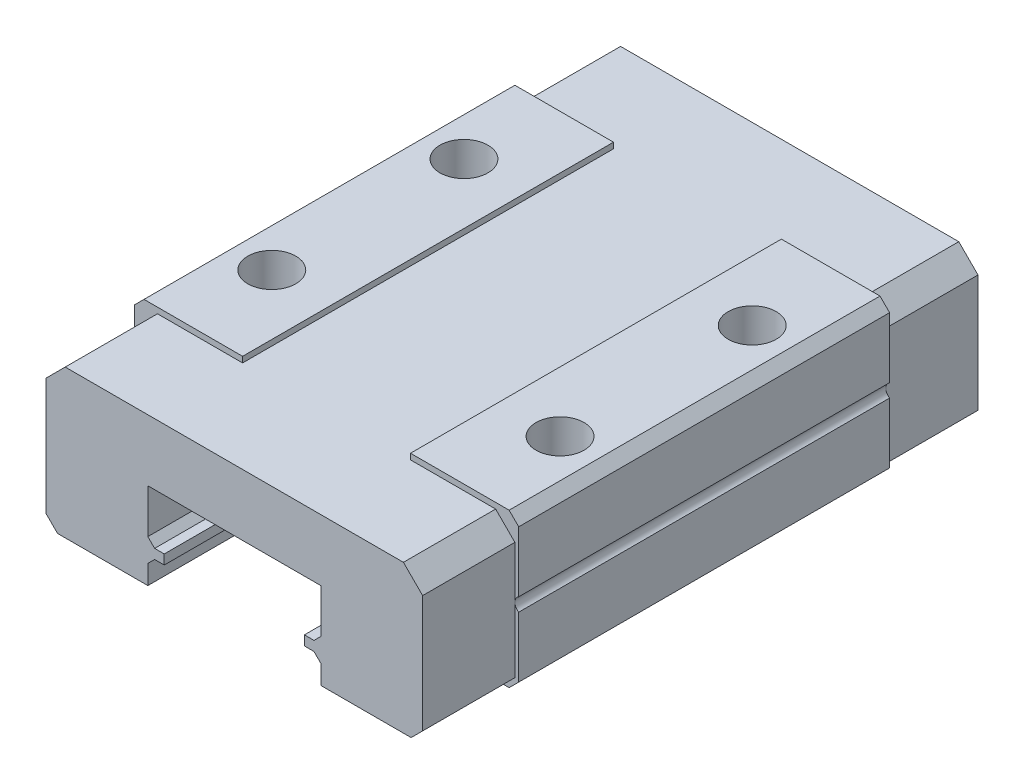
SolidWorks part; units mm, degrees
ref_plane "前视基准面" through (0, 0, 0) normal (0, 0, 1) x (1, 0, 0)
ref_plane "上视基准面" through (0, 0, 0) normal (0, 1, 0) x (1, 0, 0)
ref_plane "右视基准面" through (0, 0, 0) normal (1, 0, 0) x (0, 0, -1)
sketch "草图1" plane through (0, 0, 0) normal (0, 0, 1) x (1, 0, 0)
  line L0 (0, 0) -> (0, 18.7331) construction
  line L1 (-10, 0) -> (-10, 8)
  line L2 (4.5, 0) -> (4.5, 1)
  line L3 (4.5, 1) -> (4.1464, 1.3536)
  line L4 (4.1464, 1.3536) -> (3.6464, 1.3536)
  line L5 (3.6464, 1.3536) -> (3.6464, 1.8536)
  line L6 (3.6464, 1.8536) -> (4.1464, 1.8536)
  line L7 (4.1464, 1.8536) -> (4.5, 2.2071)
  line L8 (4.5, 2.2071) -> (4.5, 4.5)
  line L9 (4.5, 4.5) -> (-4.5, 4.5)
  line L10 (4.5, 0) -> (10, 0)
  line L11 (10, 0) -> (10, 8)
  line L12 (10, 8) -> (-10, 8)
  line L13 (-4.5, 0) -> (-10, 0)
  line L14 (-4.5, 2.2071) -> (-4.5, 4.5)
  line L15 (-4.1464, 1.8536) -> (-4.5, 2.2071)
  line L16 (-3.6464, 1.8536) -> (-4.1464, 1.8536)
  line L17 (-3.6464, 1.3536) -> (-3.6464, 1.8536)
  line L18 (-4.1464, 1.3536) -> (-3.6464, 1.3536)
  line L19 (-4.5, 1) -> (-4.1464, 1.3536)
  line L20 (-4.5, 0) -> (-4.5, 1)
  point P16 (0, 8)
  point P19 (0, 4.5)
  dimension "D1" = 4.5
  dimension "D2" = 1
  dimension "D3" = 0.5
  dimension "D4" = 0.5
  dimension "D5" = 0.5
  dimension "D6" = 4.5
  dimension "D7" = 10
  dimension "D8" = 8
extrude "凸台-拉伸1" add sketch "草图1" against normal blind 28.9
sketch "草图2" plane through (0, 8, 0) normal (0, 1, 0) x (1, 0, 0)
  line L0 (0, 28.9) -> (0, 0) construction
  line L1 (10, 28.9) -> (-10, 28.9) construction
  line L2 (10, 14.45) -> (-10, 14.45) construction
  line L3 (10, 28.9) -> (10, 0) construction
  line L4 (-10, 28.9) -> (-10, 0) construction
hole_wizard "M3 螺纹孔1" positions "草图4" profile "草图3" tap size "M3" standard "Gb"
sketch "草图4" plane through (0, 8, 0) normal (0, 1, 0) x (1, 0, 0)
  line L0 (0, 28.9) -> (0, 0) construction
  line L1 (10, 14.45) -> (-10, 14.45) construction
  point P0 (7.5, 19.45)
  dimension "D1" = 7.5
  dimension "D2" = 5
sketch "草图3" plane through (7.5, 8, -19.45) normal (1, 0, 0) x (0, 0, 1)
  line L0 (0, 0) -> (0, 3.7511)
  line L1 (0, 3.7511) -> (1.25, 3)
  line L2 (1.25, 3) -> (1.25, 0)
  line L5 (1.25, 0) -> (0, 0)
  line L10 (0, 3.7511) -> (-1.25, 3) construction
  line L11 (0, -6.35) -> (0, 107.95) construction
  dimension "螺纹孔钻头直径" = 2.5
  dimension "螺纹孔钻头深度" = 3
  dimension "导头角度" = 118
ref_plane "基准面1" through (0, 0, -14.45) normal (0, 0, -1) x (-1, 0, 0)
ref_plane "基准面2" through (0, 0, 0) normal (-1, 0, 0) x (0, 0, 1)
mirror "镜向1" about plane through (0, 0, -14.45) normal (0, 0, -1) of "M3 螺纹孔1"
mirror "镜向2" about plane through (0, 0, 0) normal (-1, 0, 0) of "镜向1", "M3 螺纹孔1"
chamfer "倒角1" distance 0.5 angle 45 2 edges at (10, 8, -14.45) (-10, 8, -14.45)
sketch "草图5" plane through (0, 8, 0) normal (0, 1, 0) x (1, 0, 0)
  line L0 (-9.5, 24.1) -> (-4.3686, 24.1)
  line L1 (-9.5, 28.9) -> (-9.5, 0) construction
  line L2 (-4.3686, 24.1) -> (-4.3686, 4.8)
  line L3 (-4.3686, 4.8) -> (-9.5, 4.8)
  line L4 (0, 28.9) -> (0, -1.0585) construction
  line L5 (9.5, 28.9) -> (-9.5, 28.9) construction
  line L6 (4.3686, 4.8) -> (9.5, 4.8)
  line L7 (4.3686, 24.1) -> (4.3686, 4.8)
  line L8 (9.5, 24.1) -> (4.3686, 24.1)
  line L9 (9.5, 0) -> (-9.5, 0) construction
  line L10 (-9.5, 24.1) -> (-10, 24.1)
  line L11 (-10, 0) -> (-10, 28.9) construction
  line L12 (-10, 24.1) -> (-10, 28.9)
  line L13 (-10, 28.9) -> (10, 28.9)
  line L14 (10, 28.9) -> (10, 24.1)
  line L15 (10, 28.9) -> (10, 0) construction
  line L16 (10, 24.1) -> (9.5, 24.1)
  line L17 (9.5, 4.8) -> (10, 4.8)
  line L18 (10, 4.8) -> (10, 0)
  line L19 (10, 0) -> (-10, 0)
  line L20 (-10, 0) -> (-10, 4.8)
  line L21 (-10, 4.8) -> (-9.5, 4.8)
  dimension "D1" = 4.8
  dimension "D2" = 4.8
extrude "切除-拉伸1" cut sketch "草图5" against normal blind 0.3
sketch "草图6" plane through (0, 7.7, 0) normal (0, 1, 0) x (1, 0, 0)
  line L0 (-10, 28.9) -> (-9.8, 28.9)
  line L1 (9.8, 28.9) -> (-9.8, 28.9) construction
  line L2 (-9.8, 28.9) -> (-9.8, 24.1)
  line L3 (-9.8, 24.1) -> (-10, 24.1)
  line L4 (-10, 0) -> (-10, 28.9) construction
  line L5 (-10, 24.1) -> (-10, 28.9)
  line L6 (0, 28.9) -> (0, 0) construction
  line L7 (-10, 14.45) -> (10, 14.45) construction
  line L8 (10, 28.9) -> (10, 0) construction
  line L9 (10, 24.1) -> (10, 28.9)
  line L10 (9.8, 24.1) -> (10, 24.1)
  line L11 (9.8, 28.9) -> (9.8, 24.1)
  line L12 (10, 28.9) -> (9.8, 28.9)
  line L13 (10, 0) -> (9.8, 0)
  line L14 (9.8, 0) -> (9.8, 4.8)
  line L15 (9.8, 4.8) -> (10, 4.8)
  line L16 (10, 4.8) -> (10, 0)
  line L17 (-10, 4.8) -> (-10, 0)
  line L18 (-9.8, 4.8) -> (-10, 4.8)
  line L19 (-9.8, 0) -> (-9.8, 4.8)
  line L20 (-10, 0) -> (-9.8, 0)
extrude "切除-拉伸2" cut sketch "草图6" against normal blind 8.3
chamfer "倒角2" distance 1 angle 45 4 edges at (-9.8, 7.7, -26.5) (9.8, 7.7, -26.5) (9.8, 7.7, -2.4) (-9.8, 7.7, -2.4)
chamfer "倒角3" distance 0.6 angle 45 4 edges at (9.8, 0, -2.4) (-9.8, 0, -2.4) (-9.8, 0, -26.5) (9.8, 0, -26.5)
chamfer "倒角4" distance 0.5 angle 45 2 edges at (10, 0, -14.45) (-10, 0, -14.45)
sketch "草图7" plane through (0, 0, -24.1) normal (0, 0, -1) x (-1, 0, 0)
  line L0 (-9.8, 0.6) -> (-9.8, 6.7) construction
  line L1 (-4.5, 0) -> (-9.2, 0) construction
  circle A0 centre (-10.2, 4) radius 0.4
  dimension "D1" = 0.8
  dimension "D2" = 0.4
  dimension "D3" = 4
extrude "切除-拉伸3" cut sketch "草图7" against normal up to surface (19.3 mm away)
